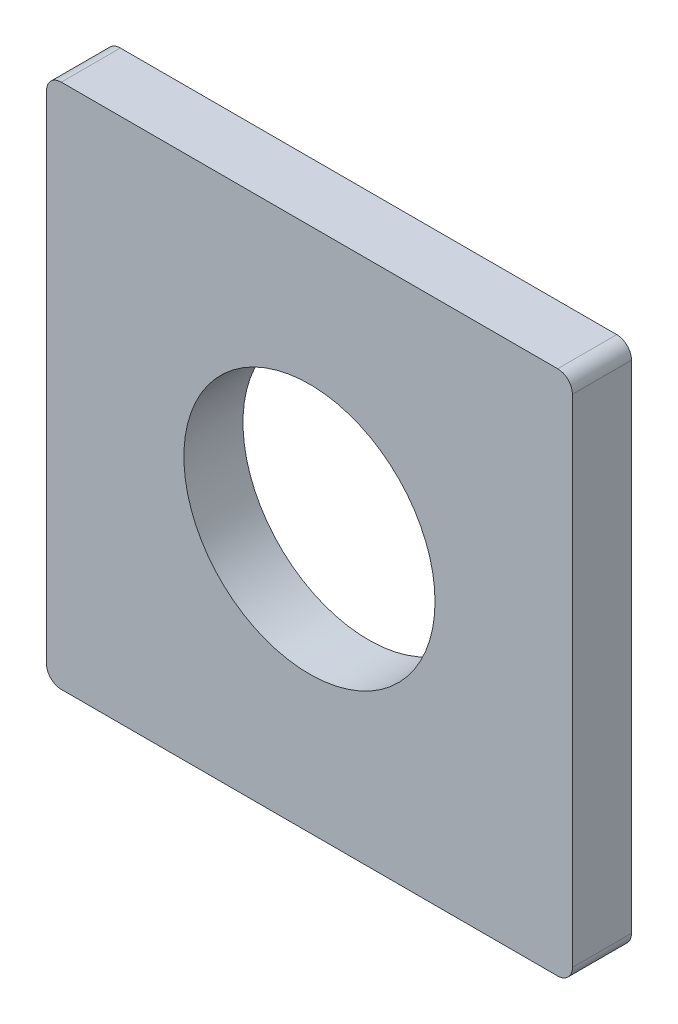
SolidWorks part; units mm, degrees
ref_plane "Front Plane" through (0, 0, 0) normal (0, 0, 1) x (1, 0, 0)
ref_plane "Top Plane" through (0, 0, 0) normal (0, 1, 0) x (1, 0, 0)
ref_plane "Right Plane" through (0, 0, 0) normal (1, 0, 0) x (0, 0, -1)
sketch "Sketch1" plane through (0, 0, 0) normal (0, 0, 1) x (1, 0, 0)
  line L1 (0.5, 0) -> (17.3, 0)
  line L2 (0, 0.5) -> (0, 17.3)
  line L3 (0.5, 17.8) -> (17.3, 17.8)
  line L4 (17.8, 0.5) -> (17.8, 17.3)
  circle A0 centre (8.9, 8.9) radius 4.25
  arc A1 (0, 0.5) -> (0.5, 0) centre (0.5, 0.5) ccw
  arc A2 (17.3, 0) -> (17.8, 0.5) centre (17.3, 0.5) ccw
  arc A3 (17.8, 17.3) -> (17.3, 17.8) centre (17.3, 17.3) ccw
  arc A4 (0.5, 17.8) -> (0, 17.3) centre (0.5, 17.3) ccw
  point P9 (0, 0)
  point P12 (17.8, 0)
  point P15 (17.8, 17.8)
  point P18 (0, 17.8)
  point P20 (8.9, 17.8)
  point P22 (0, 8.9)
  dimension "D3" = 0.5
  dimension "D4" = 8.5
  dimension "D1" = 17.8
  dimension "D2" = 17.8
extrude "Boss-Extrude1" add sketch "Sketch1" along normal blind 2
